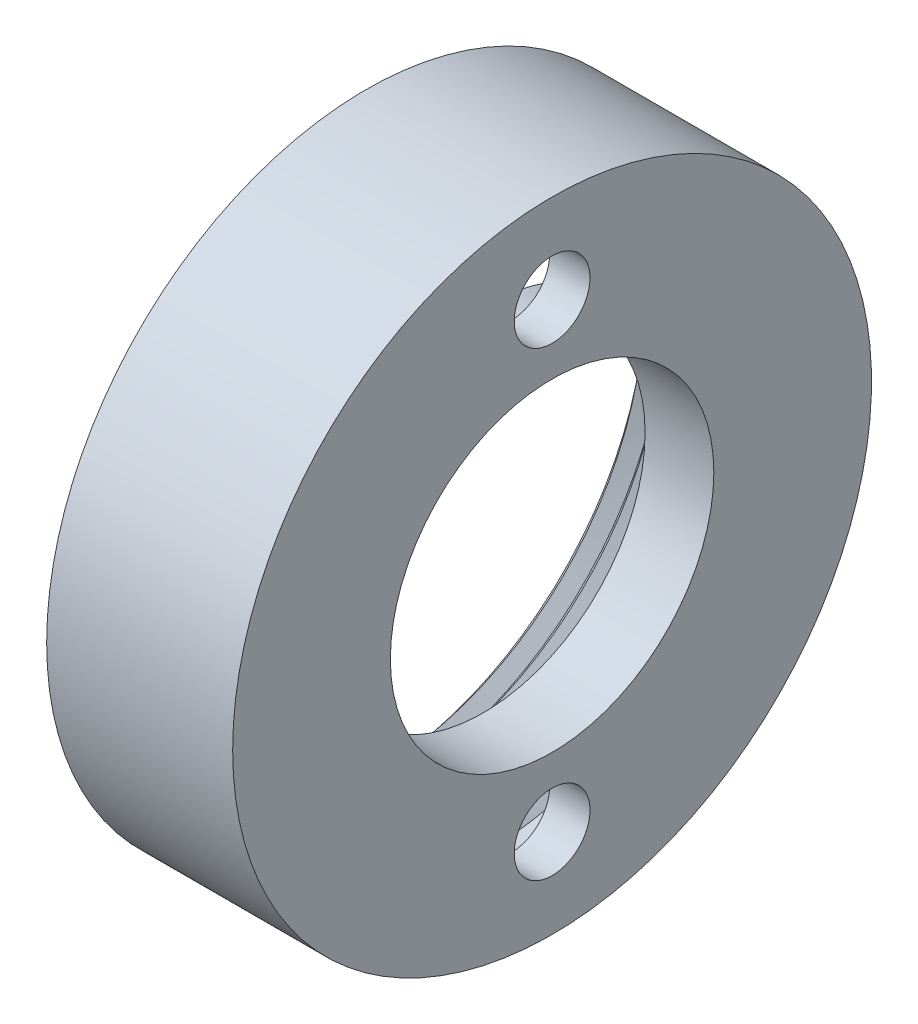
SolidWorks part; units mm, degrees
ref_plane "Front Plane" through (0, 0, 0) normal (0, 0, 1) x (1, 0, 0)
ref_plane "Top Plane" through (0, 0, 0) normal (0, 1, 0) x (1, 0, 0)
ref_plane "Right Plane" through (0, 0, 0) normal (1, 0, 0) x (0, 0, -1)
sketch "Sketch1" plane through (0, 0, 0) normal (0, 0, 1) x (1, 0, 0)
  line L0 (0, 0) -> (50.6015, 0) construction
  line L1 (0, 17.526) -> (0, 20.066)
  line L2 (0, 20.066) -> (11.684, 20.066)
  line L3 (11.684, 20.066) -> (11.684, 10.16)
  line L4 (11.684, 10.16) -> (7.366, 10.16)
  line L5 (7.366, 10.16) -> (7.366, 11.938)
  line L6 (7.366, 11.938) -> (9.144, 11.938)
  line L7 (9.144, 11.938) -> (9.144, 17.526)
  line L8 (9.144, 17.526) -> (7.62, 17.526)
  line L22 (7.62, 17.526) -> (6.985, 16.764)
  line L23 (6.985, 16.764) -> (6.35, 17.526)
  line L24 (6.35, 17.526) -> (5.715, 16.764)
  line L25 (5.715, 16.764) -> (5.08, 17.526)
  line L26 (5.08, 17.526) -> (4.445, 16.764)
  line L27 (4.445, 16.764) -> (3.81, 17.526)
  line L28 (3.81, 17.526) -> (3.175, 16.764)
  line L29 (3.175, 16.764) -> (2.54, 17.526)
  line L30 (2.54, 17.526) -> (1.905, 16.764)
  line L31 (1.905, 16.764) -> (1.27, 17.526)
  line L32 (1.27, 17.526) -> (0.635, 16.764)
  line L33 (0.635, 16.764) -> (0, 17.526)
  dimension "D1" = 20.066
  dimension "D2" = 11.684
  dimension "D3" = 9.906
  dimension "D4" = 4.318
  dimension "D5" = 1.778
  dimension "D6" = 1.778
  dimension "D7" = 5.588
  dimension "D8" = 1.524
  dimension "D9" = 17.526
revolve "Revolve1" add sketch "Sketch1" angle 360 about L0
sketch "Sketch2" plane through (11.684, 0, 0) normal (1, 0, 0) x (0, 0, -1)
  circle A1 centre (0, 14.478) radius 2.3813
  circle A2 centre (0, -14.478) radius 2.3813
extrude "Cut-Extrude1" cut sketch "Sketch2" against normal through all
